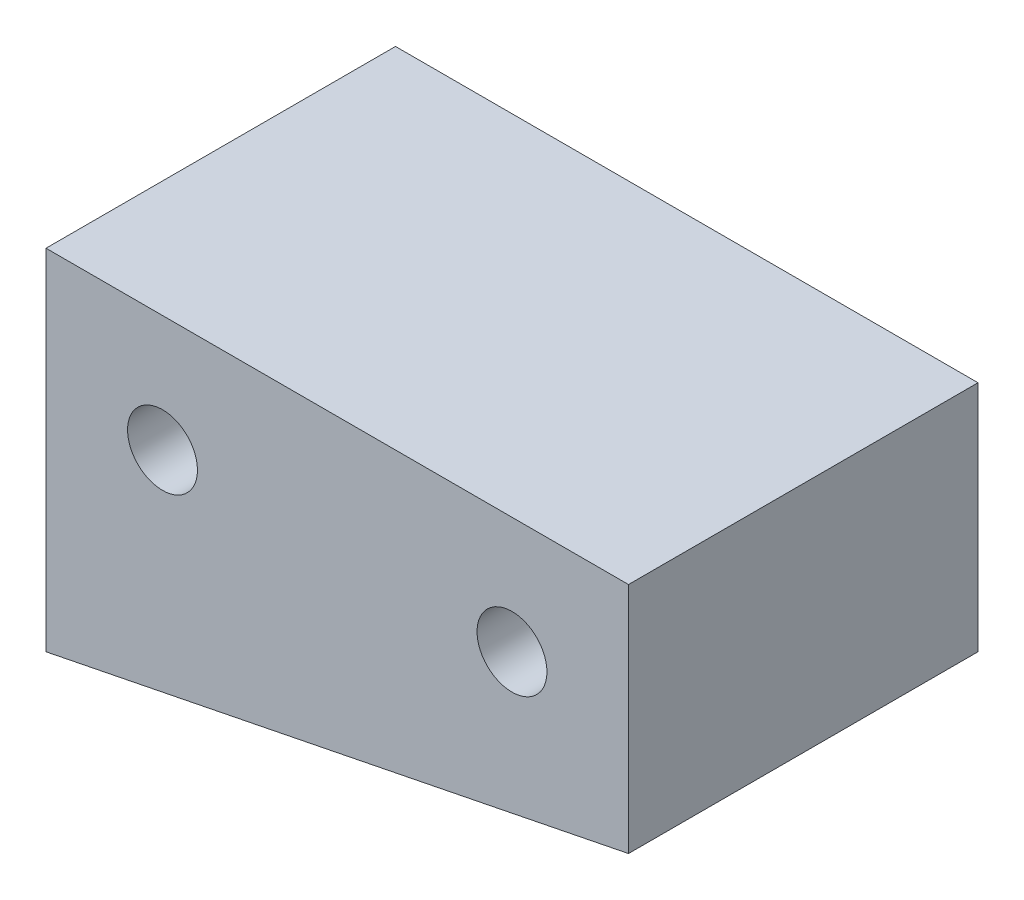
SolidWorks part; units mm, degrees
ref_plane "Plan de face" through (0, 0, 0) normal (0, 0, 1) x (1, 0, 0)
ref_plane "Plan de dessus" through (0, 0, 0) normal (0, 1, 0) x (1, 0, 0)
ref_plane "Plan de droite" through (0, 0, 0) normal (1, 0, 0) x (0, 0, -1)
sketch "Esquisse1" plane through (0, 0, 0) normal (0, 0, 1) x (1, 0, 0)
  line L1 (0, 0) -> (25, 0)
  line L2 (0, 0) -> (0, 15)
  line L3 (0, 15) -> (25, 15)
  line L4 (25, 0) -> (25, 15)
  dimension "D1" = 25
  dimension "D2" = 15
extrude "Extrusion1" add sketch "Esquisse1" along normal blind 15
sketch "Esquisse3" plane through (0, 0, 15) normal (0, 0, 1) x (1, 0, 0)
  line L0 (0, 0) -> (27.668, 5.5336)
  line L1 (27.668, 5.5336) -> (31.3268, -4.2891)
  line L2 (31.3268, -4.2891) -> (-9.5963, -10.7704)
  line L3 (-9.5963, -10.7704) -> (0, 0)
  line L4 (0, 0) -> (25, 0) construction
  dimension "D1" = 11.31
extrude "Enlèv. mat.-Extru.1" cut sketch "Esquisse3" against normal through all
sketch "Esquisse4" plane through (0, 0, 15) normal (0, 0, 1) x (1, 0, 0)
  line L0 (25, 10) -> (0, 10) construction
  line L1 (25, 5) -> (25, 15) construction
  line L2 (0, 15) -> (0, 0) construction
  circle A0 centre (20, 10) radius 1.5
  circle A1 centre (5, 10) radius 1.5
  dimension "D1" = 5
  dimension "D2" = 5
extrude "Enlèv. mat.-Extru.2" cut sketch "Esquisse4" against normal through all
chamfer "Chanfrein2" distance 1.5 angle 45 2 edges at (21.5, 10, 0) (6.5, 10, 0)
